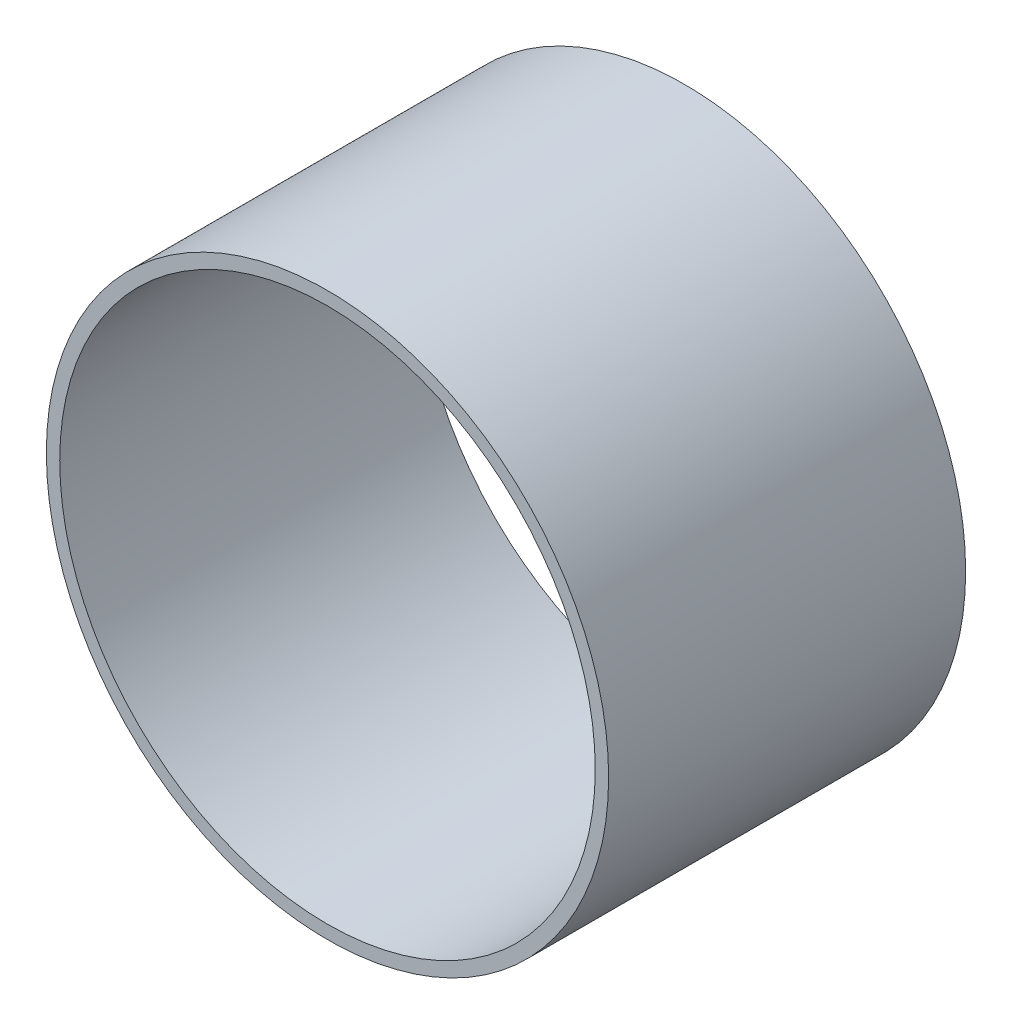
SolidWorks part; units mm, degrees
ref_plane "Face" through (0, 0, 0) normal (0, 0, 1) x (1, 0, 0)
ref_plane "Dessus" through (0, 0, 0) normal (0, 1, 0) x (1, 0, 0)
ref_plane "Droite" through (0, 0, 0) normal (1, 0, 0) x (0, 0, -1)
sketch "Esquisse1" plane through (0, 0, 0) normal (0, 0, 1) x (1, 0, 0)
  circle A0 centre (0, 0) radius 15
  circle A1 centre (0, 0) radius 15.75
  dimension "D1" = 30
  dimension "D2" = 31.5
extrude "Extrusion1" add sketch "Esquisse1" along normal blind 20
